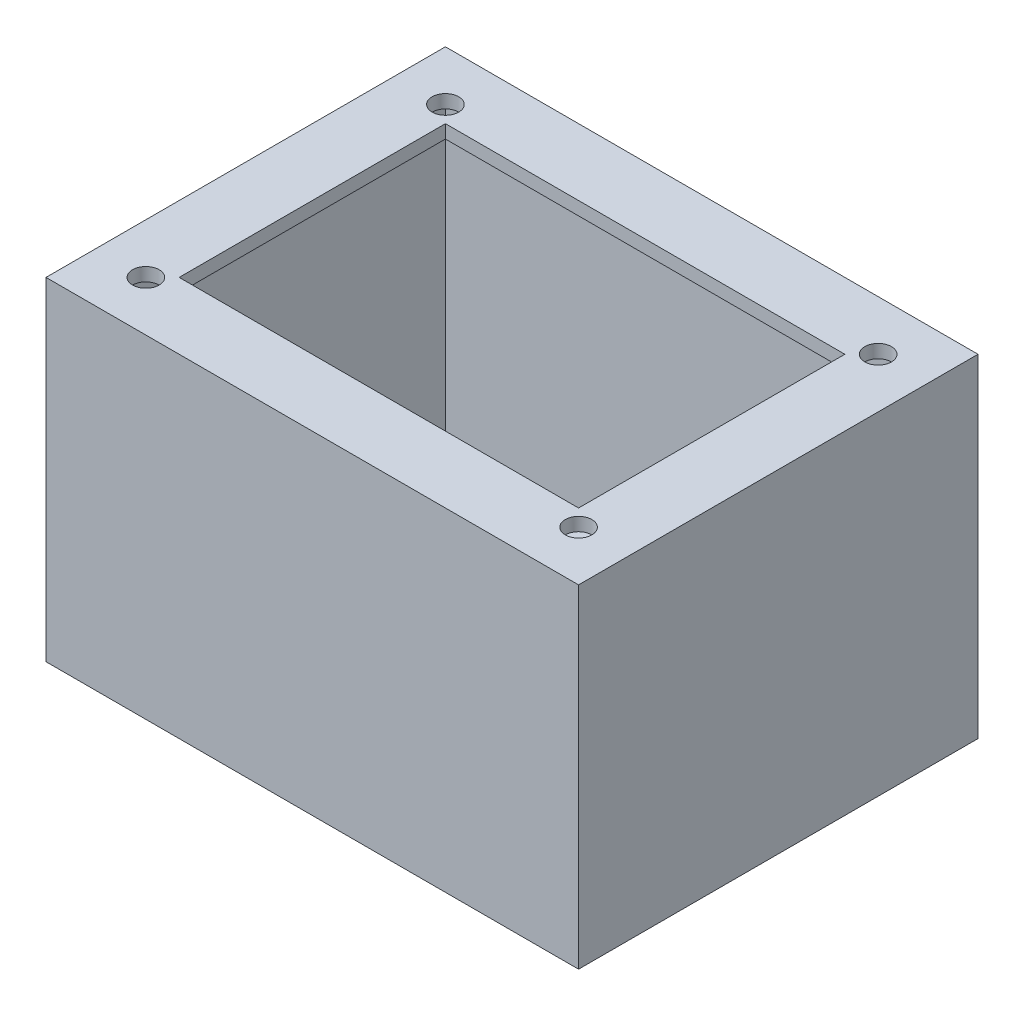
SolidWorks part; units mm, degrees
ref_plane "Front Plane" through (0, 0, 0) normal (0, 0, 1) x (1, 0, 0)
ref_plane "Top Plane" through (0, 0, 0) normal (0, 1, 0) x (1, 0, 0)
ref_plane "Right Plane" through (0, 0, 0) normal (1, 0, 0) x (0, 0, -1)
sketch "Sketch1" plane through (0, 0, 0) normal (0, 1, 0) x (1, 0, 0)
  line L1 (50.8, -38.1) -> (-50.8, -38.1)
  line L2 (50.8, -38.1) -> (50.8, 38.1)
  line L3 (50.8, 38.1) -> (-50.8, 38.1)
  line L4 (-50.8, -38.1) -> (-50.8, 38.1)
  line L5 (50.8, -38.1) -> (-50.8, 38.1) construction
  line L6 (50.8, 38.1) -> (-50.8, -38.1) construction
  point P0 (0, 0)
  dimension "D1" = 76.2
  dimension "D2" = 101.6
extrude "Boss-Extrude1" add sketch "Sketch1" along normal blind 63.5
shell "Shell1" thickness 6.35
sketch "Sketch2" plane through (0, 63.5, 0) normal (0, 1, 0) x (1, 0, 0)
  line L0 (-44.45, 31.75) -> (-44.45, -31.75) construction
  line L1 (-44.45, -31.75) -> (44.45, -31.75) construction
  line L2 (44.45, -31.75) -> (44.45, 31.75) construction
  line L3 (44.45, 31.75) -> (-44.45, 31.75) construction
  line L4 (-44.45, 31.75) -> (-44.45, -31.75)
  line L5 (-44.45, -31.75) -> (44.45, -31.75)
  line L6 (44.45, -31.75) -> (44.45, 31.75)
  line L7 (44.45, 31.75) -> (-44.45, 31.75)
  line L8 (-38.1, 25.4) -> (-38.1, -25.4)
  line L9 (-38.1, -25.4) -> (38.1, -25.4)
  line L10 (38.1, -25.4) -> (38.1, 25.4)
  line L11 (38.1, 25.4) -> (-38.1, 25.4)
  dimension "D1" = 6.35
extrude "Boss-Extrude2" add sketch "Sketch2" against normal blind 2.54
sketch "Sketch3" plane through (0, 63.5, 0) normal (0, 1, 0) x (1, 0, 0)
  line L0 (-38.1, 25.4) -> (-44.45, 31.75) construction
  circle A0 centre (-41.275, 28.575) radius 2.54
  dimension "D1" = 5.08
extrude "Cut-Extrude1" cut sketch "Sketch3" against normal up to next
mirror "Mirror1" about plane through (0, 0, 0) normal (0, 0, 1) of "Cut-Extrude1"
mirror "Mirror2" about plane through (0, 0, 0) normal (1, 0, 0) of "Mirror1", "Cut-Extrude1"
